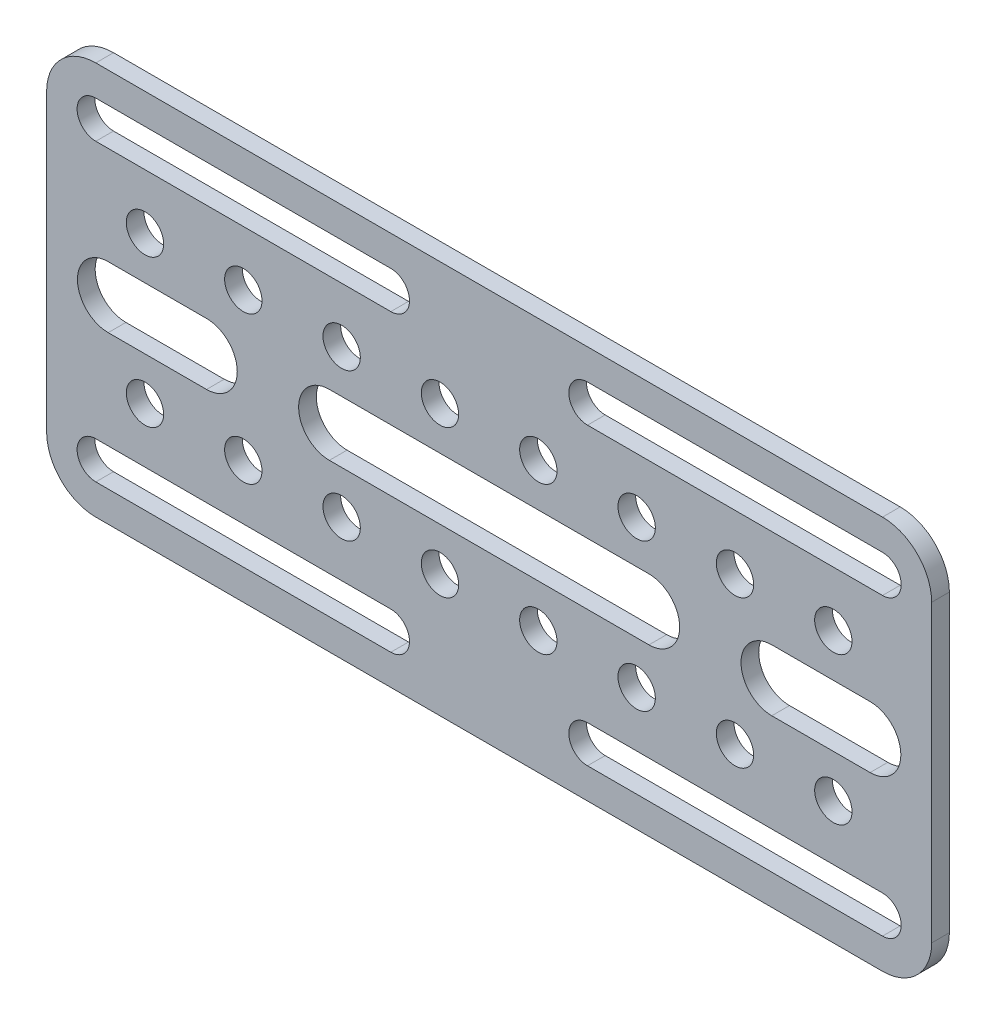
SolidWorks part; units mm, degrees
ref_plane "Front" through (0, 0, 0) normal (0, 0, 1) x (1, 0, 0)
ref_plane "Top" through (0, 0, 0) normal (0, 1, 0) x (1, 0, 0)
ref_plane "Right" through (0, 0, 0) normal (1, 0, 0) x (0, 0, -1)
sketch "Sketch1" plane through (0, 0, 0) normal (0, 0, 1) x (1, 0, 0)
  line L0 (-57.15, 25.4) -> (57.15, -25.4) construction
  line L1 (-57.15, -25.4) -> (57.15, -25.4)
  line L2 (-57.15, -25.4) -> (-57.15, 25.4)
  line L3 (-57.15, 25.4) -> (57.15, 25.4)
  line L4 (57.15, -25.4) -> (57.15, 25.4)
  dimension "D1" = 114.3
  dimension "D2" = 50.8
extrude "Extrude1" add sketch "Sketch1" along normal blind 2.286
sketch "Sketch2" plane through (0, 0, 2.286) normal (0, 0, 1) x (1, 0, 0)
  line L0 (57.15, 25.4) -> (-57.15, 25.4) construction
  line L1 (-50.8, 21.463) -> (-12.7, 21.463)
  line L2 (-50.8, 19.05) -> (-50.8, 25.4) construction
  line L3 (-50.8, 16.637) -> (-12.7, 16.637)
  line L4 (-50.8, 19.05) -> (-57.15, 19.05) construction
  line L5 (-57.15, 25.4) -> (-57.15, -25.4) construction
  arc A0 (-12.7, 21.463) -> (-12.7, 16.637) centre (-12.7, 19.05) cw
  arc A1 (-50.8, 16.637) -> (-50.8, 21.463) centre (-50.8, 19.05) cw
  dimension "D2" = 2.413
  dimension "D1" = 38.1
  dimension "D4" = 6.35
extrude "Cut-Extrude1" cut sketch "Sketch2" against normal through all
pattern_linear "LPattern1" count 2 spacing 63.5 along (1, 0, 0) count 2 spacing 38.1 along (0, -1, 0) of "Cut-Extrude1"
sketch "Sketch5" plane through (0, 0, 2.286) normal (0, 0, 1) x (1, 0, 0)
  line L3 (-57.15, 25.4) -> (-57.15, -25.4) construction
  circle A0 centre (-44.45, 9.525) radius 2.413
  dimension "D1" = 9.525
  dimension "D2" = 4.826
  dimension "D3" = 12.7
extrude "Cut-Extrude4" cut sketch "Sketch5" against normal through all
pattern_linear "LPattern3" count 8 spacing 12.7 along (1, 0, 0) count 2 spacing 19.05 along (0, -1, 0) of "Cut-Extrude4"
sketch "Sketch6" plane through (0, 0, 2.286) normal (0, 0, 1) x (1, 0, 0)
  line L0 (0, 0) -> (0, 25.4) construction
  line L1 (-20.6375, 3.9687) -> (20.6375, 3.9687)
  line L2 (20.6375, 0) -> (-20.6375, 0) construction
  line L3 (-20.6375, -3.9688) -> (20.6375, -3.9688)
  line L4 (57.15, 25.4) -> (-57.15, 25.4) construction
  line L7 (-57.15, 25.4) -> (-57.15, -25.4) construction
  line L8 (-49.1998, 3.9688) -> (-36.4998, 3.9688)
  line L10 (-49.1998, -3.9687) -> (-36.4998, -3.9687)
  line L12 (49.1998, 3.9688) -> (36.4998, 3.9688)
  line L14 (49.1998, -3.9687) -> (36.4998, -3.9687)
  arc A0 (20.6375, 3.9687) -> (20.6375, -3.9688) centre (20.6375, 0) cw
  arc A1 (-20.6375, 3.9687) -> (-20.6375, -3.9688) centre (-20.6375, 0) ccw
  arc A2 (-36.4998, 3.9688) -> (-36.4998, -3.9687) centre (-36.4998, 0) cw
  arc A3 (36.4998, 3.9688) -> (36.4998, -3.9687) centre (36.4998, 0) ccw
  arc A4 (-49.1998, 3.9688) -> (-49.1998, -3.9687) centre (-49.1998, 0) ccw
  arc A5 (49.1998, 3.9688) -> (49.1998, -3.9687) centre (49.1998, 0) cw
  dimension "D1" = 3.9688
  dimension "D3" = 12.7
  dimension "D2" = 41.275
  dimension "D4" = 7.9502
extrude "Cut-Extrude5" cut sketch "Sketch6" against normal through all
fillet "Fillet1" radius 6.35 4 edges at (-57.15, -25.4, 1.143) (57.15, -25.4, 1.143) (57.15, 25.4, 1.143) (-57.15, 25.4, 1.143)
